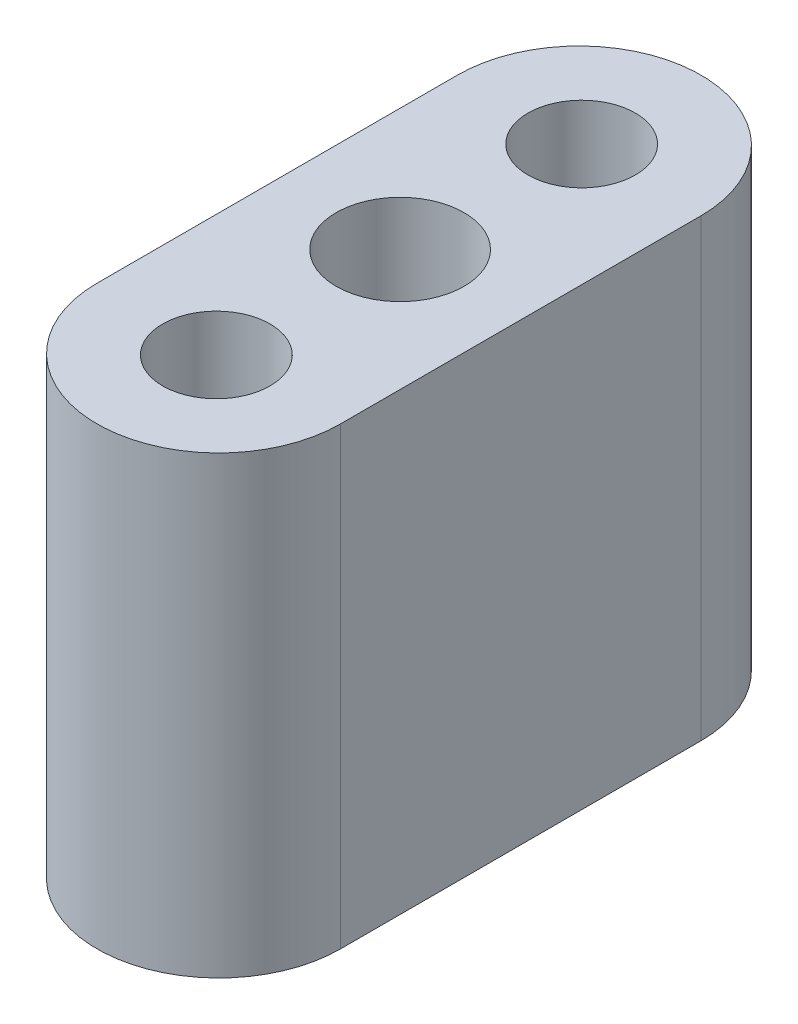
SolidWorks part; units mm, degrees
ref_plane "Front Plane" through (0, 0, 0) normal (0, 0, 1) x (1, 0, 0)
ref_plane "Top Plane" through (0, 0, 0) normal (0, 1, 0) x (1, 0, 0)
ref_plane "Right Plane" through (0, 0, 0) normal (1, 0, 0) x (0, 0, -1)
sketch "Sketch1" plane through (0, 0, 0) normal (0, 1, 0) x (1, 0, 0)
  line L0 (-4.7625, 7.0485) -> (-4.7625, -7.0485)
  line L1 (4.7625, -7.0485) -> (4.7625, 7.0485)
  arc A0 (-4.7625, -7.0485) -> (4.7625, -7.0485) centre (0, -7.0485) ccw
  arc A1 (4.7625, 7.0485) -> (-4.7625, 7.0485) centre (0, 7.0485) ccw
  dimension "D1" = 9.525
  dimension "D2" = 14.097
  dimension "D3" = 7.0485
extrude "Extrude1" add sketch "Sketch1" along normal blind 17.78
hole_wizard "M5x0.8 Tapped Hole1" positions "3DSketch1" profile "Sketch2" tap size "M5x0.8" standard "ANSI Metric"
sketch3d "3DSketch1"
  arc A0 (-4.7625, 17.78, 7.0485) -> (4.7625, 17.78, 7.0485) centre (0, 17.78, 7.0485) ccw construction
  arc A1 (4.7625, 17.78, -7.0485) -> (-4.7625, 17.78, -7.0485) centre (0, 17.78, -7.0485) ccw construction
  point P0 (0, 17.78, -7.0485)
  point P2 (0, 17.78, 7.0485)
  point P8 (0, 22.5425, 7.0485)
  point P13 (0, 22.5425, -7.0485)
sketch "Sketch2" plane through (0, 17.78, -7.0485) normal (1, 0, 0) x (0, 0, 1)
  line L0 (0, 0) -> (0, 13.9618)
  line L1 (0, 13.9618) -> (2.1, 12.7)
  line L2 (2.1, 12.7) -> (2.1, 0)
  line L5 (2.1, 0) -> (0, 0)
  line L10 (0, 13.9618) -> (-2.1, 12.7) construction
  line L11 (0, -6.35) -> (0, 107.95) construction
  dimension "Tap Drill Dia." = 4.2
  dimension "Tap Drill Depth" = 12.7
  dimension "Drill Angle" = 118
sketch "Sketch4" plane through (0, 17.78, 0) normal (0, 1, 0) x (1, 0, 0)
  point P0 (0, 0)
hole_wizard "Ø5.0 (5) Diameter Hole1" positions "3DSketch2" profile "Sketch3" hole size "Ø5.0" standard "ANSI Metric"
sketch3d "3DSketch2"
  point P0 (0.0217, 17.78, -0.0217)
sketch "Sketch3" plane through (0.0217, 17.78, -0.0217) normal (1, 0, 0) x (0, 0, 1)
  line L0 (0, 0) -> (0, 7.4966)
  line L1 (0, 7.4966) -> (2.5, 5.9944)
  line L2 (2.5, 5.9944) -> (2.5, 0)
  line L5 (2.5, 0) -> (0, 0)
  line L10 (0, 7.4966) -> (-2.5, 5.9944) construction
  line L11 (0, -6.35) -> (0, 107.95) construction
  dimension "Hole Dia." = 5
  dimension "Hole Depth" = 5.9944
  dimension "Drill Angle" = 118
hole_wizard "M5x0.8 Tapped Hole2" positions "Sketch5" profile "Sketch6" tap size "M5x0.8" standard "ANSI Metric"
sketch "Sketch5" plane through (0, 17.78, 0) normal (0, 1, 0) x (-1, 0, 0)
  point P0 (0, -7.1425)
  point P2 (0, 7.1425)
  dimension "D1" = 7.1425
  dimension "D2" = 7.1425
sketch "Sketch6" plane through (0, 17.78, -7.1425) normal (1, 0, 0) x (0, 0, 1)
  line L0 (0, 0) -> (0, 15.2572)
  line L1 (0, 15.2572) -> (2.1, 13.9954)
  line L2 (2.1, 13.9954) -> (2.1, 0)
  line L5 (2.1, 0) -> (0, 0)
  line L10 (0, 15.2572) -> (-2.1, 13.9954) construction
  line L11 (0, -6.35) -> (0, 107.95) construction
  dimension "Tap Drill Dia." = 4.2
  dimension "Tap Drill Depth" = 13.9954
  dimension "Drill Angle" = 118
